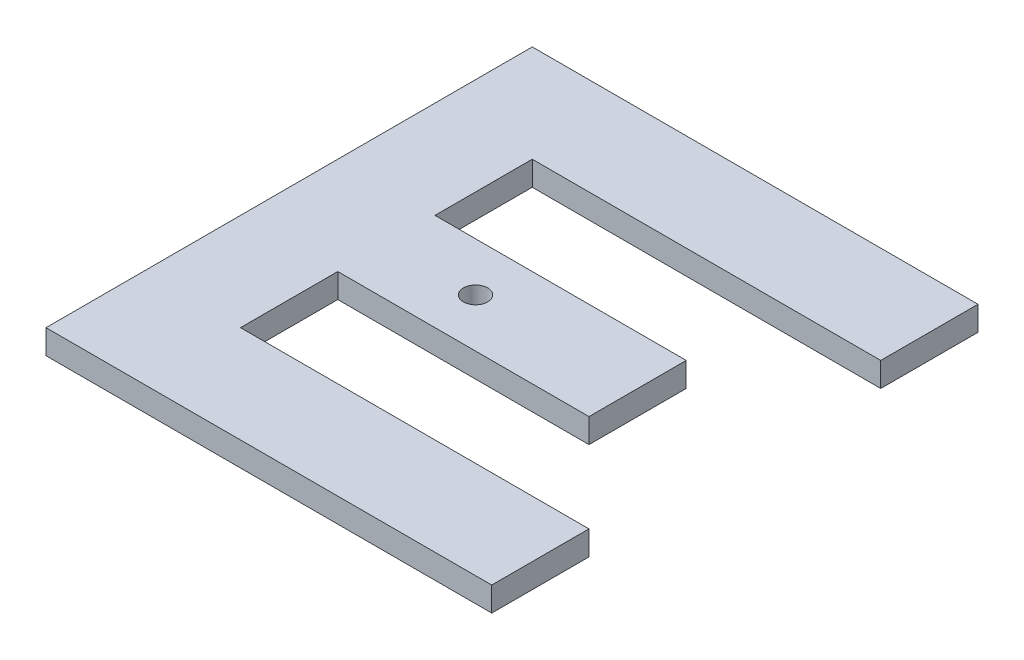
SolidWorks part; units mm, degrees
ref_plane "Front" through (0, 0, 0) normal (0, 0, 1) x (1, 0, 0)
ref_plane "Top" through (0, 0, 0) normal (0, 1, 0) x (1, 0, 0)
ref_plane "Right" through (0, 0, 0) normal (1, 0, 0) x (0, 0, -1)
sketch "Sketch1" plane through (0, 0, 0) normal (0, 1, 0) x (1, 0, 0)
  line L0 (12, 48) -> (55, 48)
  line L1 (0, 0) -> (55, 0)
  line L2 (0, 0) -> (0, 60)
  line L3 (0, 60) -> (55, 60)
  line L4 (55, 0) -> (55, 12)
  line L5 (12, 36) -> (43, 36)
  line L6 (12, 24) -> (43, 24)
  line L7 (12, 12) -> (55, 12)
  line L8 (12, 12) -> (12, 24)
  line L9 (12, 36) -> (12, 48)
  line L11 (55, 48) -> (55, 60)
  line L17 (0, 36) -> (55, 36) construction
  line L18 (0, 24) -> (55, 24) construction
  line L19 (43, 24) -> (43, 36)
  line L21 (12, 0) -> (12, 60) construction
  line L22 (0, 48) -> (55, 48) construction
  line L23 (0, 12) -> (55, 12) construction
  circle A0 centre (23, 30) radius 1.5
extrude "Extrude1" add sketch "Sketch1" along normal blind 3
